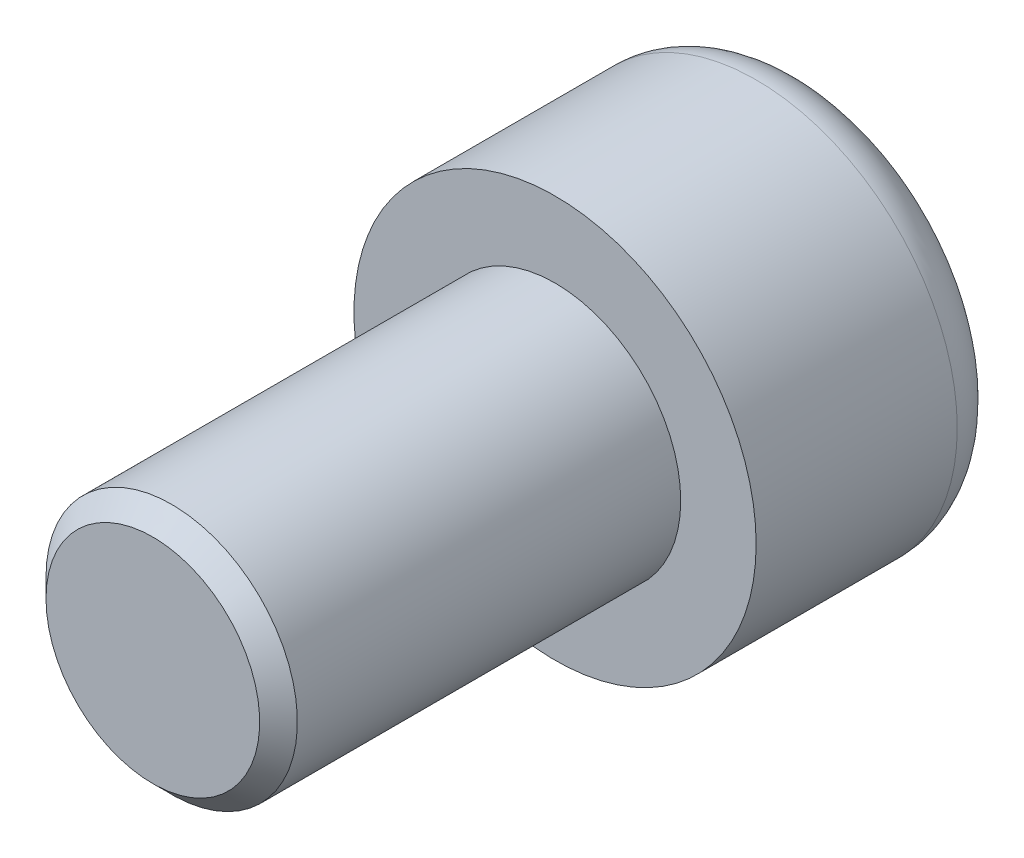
SolidWorks part; units mm, degrees
ref_plane "Plan1" through (0, 0, 0) normal (0, 0, 1) x (1, 0, 0)
ref_plane "Plan2" through (0, 0, 0) normal (0, 1, 0) x (1, 0, 0)
ref_plane "Plan3" through (0, 0, 0) normal (1, 0, 0) x (0, 0, -1)
sketch "profil tête" plane through (0, 0, 0) normal (0, 0, 1) x (1, 0, 0)
  circle A0 centre (0, 0) radius 8
  dimension "DIAMETRE" = 16
extrude "TETE" add sketch "profil tête" along normal blind 10
sketch "profil six pans" plane through (0, 0, 0) normal (0, 0, -1) x (-1, 0, 0)
  line L0 (0, 4.6188) -> (0, -4.6188) construction
  line L1 (0, 4.6188) -> (-4, 2.3094)
  line L2 (0, 4.6188) -> (4, 2.3094)
  line L3 (-4, 2.3094) -> (-4, -2.3094)
  line L4 (4, 2.3094) -> (4, -2.3094)
  line L5 (-4, -2.3094) -> (0, -4.6188)
  line L6 (4, -2.3094) -> (0, -4.6188)
  line L7 (-4, 2.3094) -> (4, -2.3094) construction
  line L8 (-4, -2.3094) -> (4, 2.3094) construction
  dimension "D1" = 60
  dimension "LARGEUR" = 8
extrude "SIX PANS" cut sketch "profil six pans" against normal blind 6.25
fillet "CONGE" radius 2 1 edges at (8, 0, 0)
sketch "profil cylindre" plane through (0, 0, 10) normal (0, 0, 1) x (1, 0, 0)
  circle A0 centre (0, 0) radius 5
  dimension "DIAMETRE" = 10
extrude "CYLINDRE FILETE" add sketch "profil cylindre" along normal blind 16
revolve "CHANFREIN FILET" cut sketch "profil chanfrein" angle 360 about L4
sketch "profil chanfrein" plane through (0, 0, 0) normal (1, 0, 0) x (0, 0, -1)
  line L0 (-26, 4.25) -> (-25.25, 5)
  line L1 (-26, 5) -> (-26, -5) construction
  line L2 (-26, 5) -> (-25.25, 5)
  line L3 (-10, 5) -> (-26, 5) construction
  line L4 (-12.0874, 0) -> (-18.1046, 0) construction
  line L5 (-26, 0) -> (-10, 0) construction
  line L8 (-26, 5) -> (-26, 4.25)
  dimension "D1" = 45
  dimension "D2" = 8.5
equation "\"D2@profil chanfrein\" = \"DIAMETRE FOND FILET@Représentation de filetage1\""
equation "\"HAUTEUR@TETE\"=\"DIAMETRE@profil cylindre\""
equation "\"PROFONDEUR@SIX PANS\" = \"HAUTEUR@TETE\" * 0.625"
equation "\"RAYON@CONGE\"=\"HAUTEUR@TETE\"/5"
